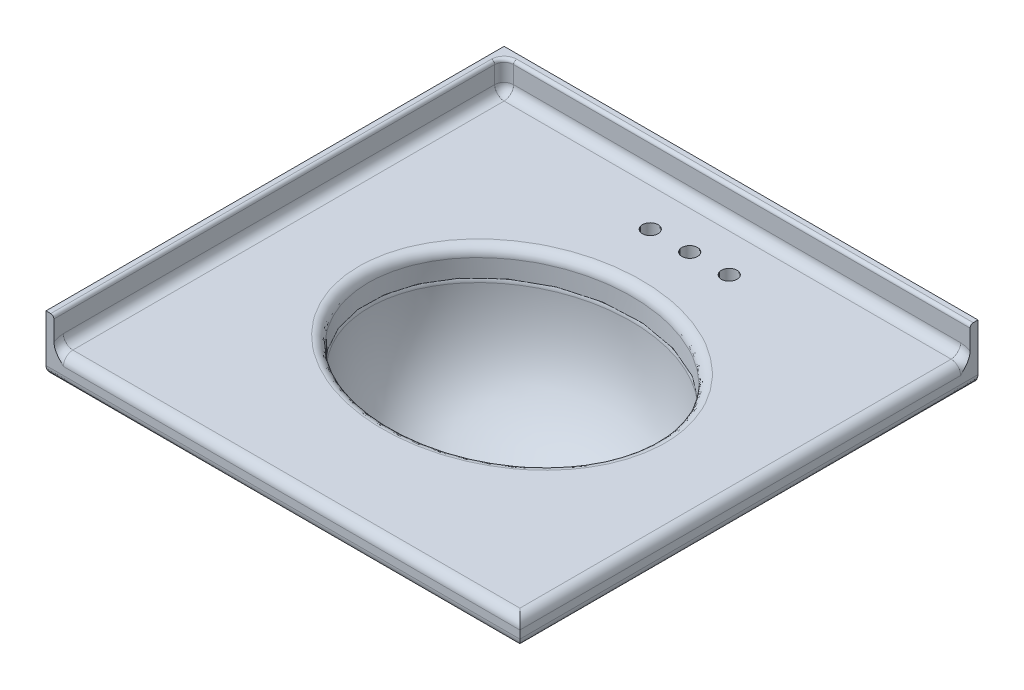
SolidWorks part; units mm, degrees
ref_plane "Front" through (0, 0, 0) normal (0, 0, 1) x (1, 0, 0)
ref_plane "Top" through (0, 0, 0) normal (0, 1, 0) x (1, 0, 0)
ref_plane "Right" through (0, 0, 0) normal (1, 0, 0) x (0, 0, -1)
sketch "Sketch1" plane through (0, 0, 0) normal (0, 1, 0) x (1, 0, 0)
  line L1 (0, 0) -> (600, 0)
  line L2 (0, 0) -> (0, 580)
  line L3 (0, 580) -> (600, 580)
  line L4 (600, 0) -> (600, 580)
  dimension "D1" = 600
  dimension "D2" = 580
extrude "Boss-Extrude1" add sketch "Sketch1" against normal blind 34
sketch "Sketch14" plane through (0, 0, 0) normal (0, 1, 0) x (1, 0, 0)
  line L0 (600, 580) -> (0, 580) construction
  line L1 (0, 580) -> (0, 0) construction
  line L2 (600, 580) -> (0, 580)
  line L3 (0, 580) -> (0, 0)
extrude "Extrude-Thin1" add sketch "Sketch14" along normal blind 38 thin
sketch "Sketch4" plane through (0, 0, 0) normal (0, 1, 0) x (1, 0, 0)
  line L2 (600, 570) -> (10, 570) construction
  line L3 (10, 570) -> (10, 0) construction
  ellipse E0 centre (305, 285) end of major axis (486.8224, 285) minor radius 151.6525
  point P8 (305, 570)
  point P11 (10, 285)
extrude "Cut-Extrude1" cut sketch "Sketch4" against normal through all
sketch "Sketch5" plane through (0, -34, 0) normal (0, -1, 0) x (-1, 0, 0)
  ellipse E0 centre (-305, 285) end of major axis (-123.1776, 285) minor radius 151.6525
  ellipse E1 centre (-305, 285) end of major axis (-486.8224, 285) minor radius 151.6525 construction
ref_plane "Plane1" through (0, -201.0163, 0) normal (0, 1, 0) x (-1, 0, 0)
sketch "Sketch11" plane through (0, -201.0163, 0) normal (0, 1, 0) x (-1, 0, 0)
  circle A0 centre (-305, -285) radius 25
loft "Loft1" add profiles "Sketch5", "Sketch11"
shell "Shell1" thickness 1
sketch "Sketch13" plane through (0, 0, 0) normal (0, 1, 0) x (1, 0, 0)
  line L0 (255, 510) -> (355, 510) construction
  line L1 (355, 520) -> (255, 520) construction
  line L2 (305, 510) -> (305, 285) construction
  circle A0 centre (355, 510) radius 10
  circle A1 centre (255, 510) radius 10
  circle A2 centre (305, 510) radius 10
  dimension "D2" = 20
  dimension "D1" = 100
  dimension "D3" = 225
extrude "Cut-Extrude2" cut sketch "Sketch13" against normal blind 280
fillet "Fillet1" radius 12 6 edges at (600, -34, -290) (300, -34, 0) (486.8224, 0, -285) (10, 19, -570)
fillet "Fillet2" radius 12 1 edges at (126.0136, -34, -263.585)
fillet "Fillet3" radius 12 5 edges at (596.4853, -3.5147, -570) (13.5147, 0, -566.4853) (10, -3.5147, -3.5147)
fillet "Fillet4" radius 4 3 edges at (311, 38, -570) (13.5147, 38, -566.4853) (10, 38, -279)
